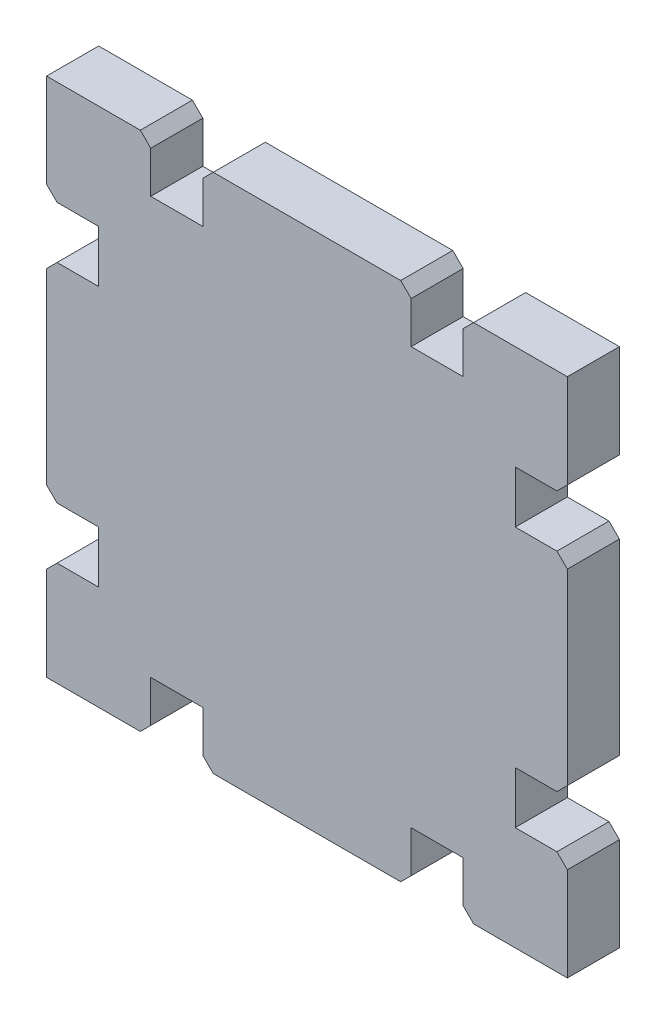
SolidWorks part; units mm, degrees
ref_plane "Front Plane" through (0, 0, 0) normal (0, 0, 1) x (1, 0, 0)
ref_plane "Top Plane" through (0, 0, 0) normal (0, 1, 0) x (1, 0, 0)
ref_plane "Right Plane" through (0, 0, 0) normal (1, 0, 0) x (0, 0, -1)
sketch "Sketch1" plane through (0, 0, 0) normal (0, 0, 1) x (1, 0, 0)
  line L0 (-25, 16) -> (-25, 25)
  line L1 (-25, -25) -> (-16, -25)
  line L2 (-25, -25) -> (-25, -16)
  line L3 (-25, 25) -> (-16, 25)
  line L4 (25, -25) -> (25, -16)
  line L5 (0, 25) -> (0, -25) construction
  line L6 (-25, 0) -> (25, 0) construction
  line L7 (-24, -10) -> (-20, -10)
  line L8 (-20, 10) -> (-20, 15)
  line L9 (-20, -10) -> (-20, -15)
  line L10 (-24, 10) -> (-20, 10)
  line L11 (-24, 15) -> (-20, 15)
  line L12 (-24, -15) -> (-20, -15)
  line L13 (-25, -9) -> (-25, 9)
  line L14 (24, -15) -> (20, -15)
  line L15 (20, -10) -> (20, -15)
  line L16 (24, -10) -> (20, -10)
  line L17 (24, 10) -> (20, 10)
  line L18 (20, 10) -> (20, 15)
  line L19 (24, 15) -> (20, 15)
  line L20 (25, 16) -> (25, 25)
  line L21 (25, -9) -> (25, 9)
  line L22 (16, 25) -> (25, 25)
  line L23 (-15, 24) -> (-15, 20)
  line L24 (-10, 20) -> (-15, 20)
  line L25 (-10, 24) -> (-10, 20)
  line L26 (10, 24) -> (10, 20)
  line L27 (10, 20) -> (15, 20)
  line L28 (15, 24) -> (15, 20)
  line L29 (-9, 25) -> (9, 25)
  line L30 (15, -24) -> (15, -20)
  line L31 (10, -20) -> (15, -20)
  line L32 (10, -24) -> (10, -20)
  line L33 (-15, -24) -> (-15, -20)
  line L34 (-10, -20) -> (-15, -20)
  line L35 (-10, -24) -> (-10, -20)
  line L36 (16, -25) -> (25, -25)
  line L37 (-9, -25) -> (9, -25)
  line L38 (-16, 25) -> (-15, 24)
  line L39 (-10, 24) -> (-9, 25)
  line L40 (-24, 15) -> (-25, 16)
  line L41 (-25, 9) -> (-24, 10)
  line L42 (-24, -10) -> (-25, -9)
  line L43 (-25, -16) -> (-24, -15)
  line L44 (-16, -25) -> (-15, -24)
  line L45 (-9, -25) -> (-10, -24)
  line L46 (9, -25) -> (10, -24)
  line L47 (16, -25) -> (15, -24)
  line L48 (25, -16) -> (24, -15)
  line L49 (25, -9) -> (24, -10)
  line L50 (25, 9) -> (24, 10)
  line L51 (25, 16) -> (24, 15)
  line L52 (15, 24) -> (16, 25)
  line L53 (9, 25) -> (10, 24)
  point P0 (0, 0)
  point P4 (-25, -10)
  point P7 (-25, -15)
  point P8 (25, -15)
  point P11 (25, -10)
  point P12 (25, 10)
  point P17 (-25, 10)
  point P18 (25, 15)
  point P19 (-25, 15)
  point P20 (-15, 25)
  point P21 (15, -25)
  point P24 (-10, 25)
  point P25 (10, 25)
  point P28 (15, 25)
  point P31 (10, -25)
  point P32 (-15, -25)
  point P35 (-10, -25)
extrude "Boss-Extrude1" add sketch "Sketch1" along normal blind 5
equation "\"t\"= 5mm'slot"
equation "\"D3@Sketch1\"=\"t\""
equation "\"D4@Sketch1\"=\"t\""
equation "\"D5@Sketch1\"=\"t\""
